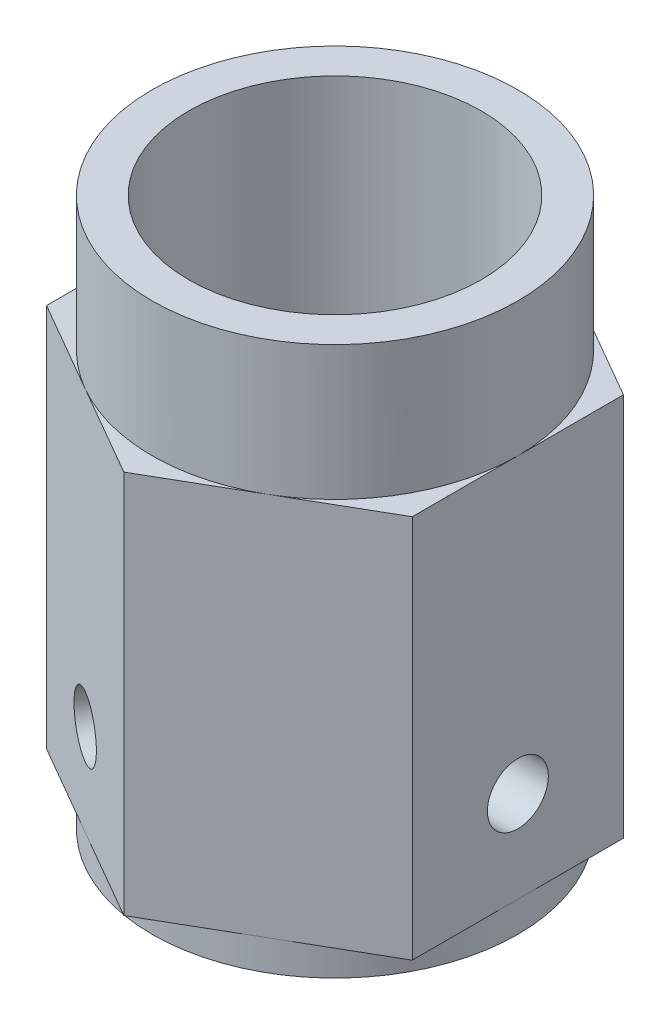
SolidWorks part; units mm, degrees
ref_plane "前视基准面" through (0, 0, 0) normal (0, 0, 1) x (1, 0, 0)
ref_plane "上视基准面" through (0, 0, 0) normal (0, 1, 0) x (1, 0, 0)
ref_plane "右视基准面" through (0, 0, 0) normal (1, 0, 0) x (0, 0, -1)
sketch "草图1" plane through (0, 0, 0) normal (0, 1, 0) x (1, 0, 0)
  line L1 (0, 34.641) -> (-30, 17.3205)
  line L2 (-30, 17.3205) -> (-30, -17.3205)
  line L3 (-30, -17.3205) -> (0, -34.641)
  line L4 (0, -34.641) -> (30, -17.3205)
  line L5 (30, -17.3205) -> (30, 17.3205)
  line L6 (30, 17.3205) -> (0, 34.641)
  circle A0 centre (0, 0) radius 30 construction
extrude "凸台-拉伸1" add sketch "草图1" along normal blind 63
sketch "草图2" plane through (0, 63, 0) normal (0, 1, 0) x (1, 0, 0)
  circle A0 centre (0, 0) radius 30
extrude "凸台-拉伸2" add sketch "草图2" along normal blind 22
sketch "草图3" plane through (0, 0, 0) normal (0, -1, 0) x (1, 0, 0)
  circle A0 centre (0, 0) radius 30
extrude "凸台-拉伸3" add sketch "草图3" along normal blind 5 separate body
sketch "草图4" plane through (0, -5, 0) normal (0, -1, 0) x (1, 0, 0)
  circle A0 centre (0, 0) radius 15
extrude "切除-拉伸1" cut sketch "草图4" against normal blind 45
sketch "草图5" plane through (0, 85, 0) normal (0, 1, 0) x (1, 0, 0)
  circle A0 centre (0, 0) radius 24
extrude "切除-拉伸2" cut sketch "草图5" against normal blind 45
sketch "草图6" plane through (-15, 0, -25.9808) normal (-0.5, 0, -0.866) x (-0.866, 0, 0.5)
  line L0 (-30, -5) -> (30, -5) construction
  circle A0 centre (0, 15) radius 5
  dimension "D1" = 20
extrude "切除-拉伸3" cut sketch "草图6" against normal up to surface (15.8579 mm away)
sketch "草图7" plane through (30, 0, 0) normal (1, 0, 0) x (0, 0, -1)
  line L0 (-30, -5) -> (30, -5) construction
  circle A0 centre (0, 15) radius 5
  dimension "D1" = 10
  dimension "D2" = 20
extrude "切除-拉伸4" cut sketch "草图7" against normal up to surface (15.8579 mm away)
sketch "草图8" plane through (-15, 0, 25.9808) normal (-0.5, 0, 0.866) x (0.866, 0, 0.5)
  line L0 (-30, -5) -> (30, -5) construction
  circle A0 centre (0, 15) radius 5
  dimension "D1" = 20
extrude "切除-拉伸5" cut sketch "草图8" against normal up to surface (15.8579 mm away)
